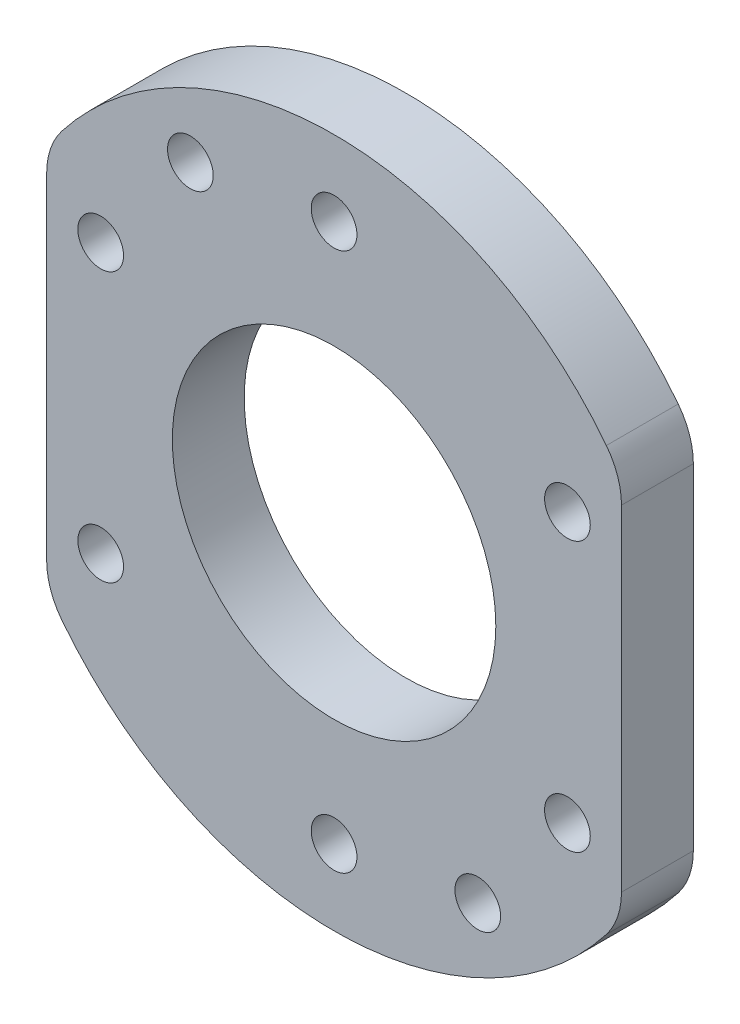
SolidWorks part; units mm, degrees
ref_plane "Front" through (0, 0, 0) normal (0, 0, 1) x (1, 0, 0)
ref_plane "Top" through (0, 0, 0) normal (0, 1, 0) x (1, 0, 0)
ref_plane "Right" through (0, 0, 0) normal (1, 0, 0) x (0, 0, -1)
sketch "Sketch1" plane through (0, 0, 0) normal (0, 0, 1) x (1, 0, 0)
  line L0 (-25.4, 16.8485) -> (-25.4, -16.8485)
  line L1 (-7.3323, 0) -> (-3.6662, -6.35)
  line L2 (-3.6662, -6.35) -> (3.6662, -6.35)
  line L3 (3.6662, -6.35) -> (7.3323, 0)
  line L4 (7.3323, 0) -> (3.6662, 6.35)
  line L5 (3.6662, 6.35) -> (-3.6662, 6.35)
  line L6 (-3.6662, 6.35) -> (-7.3323, 0)
  line L7 (25.4, 16.8485) -> (25.4, -16.8485)
  circle A0 centre (0, 0) radius 6.35 construction
  circle A1 centre (0, 0) radius 30.48
  circle A2 centre (0, 0) radius 23.8125 construction
  dimension "D2" = 60.96
  dimension "D3" = 47.625
  dimension "D1" = 12.7
  dimension "D4" = 25.4
  dimension "D5" = 25.4
extrude "Boss-Extrude1" add sketch "Sketch1" along normal blind 6.35 contours L7 A1 L0 L6 L5 L4 L3 L2 L1
hole_wizard "Tap Drill for #10-32 Tap3" positions "3DSketch2" profile "Sketch4" hole size "#10-32" standard "ANSI Inch"
sketch3d "3DSketch2"
  line L0 (0, 23.8125, 6.35) -> (0, 0, 6.35) construction
  point P0 (0, 23.8125, 6.35)
  point P3 (0, 23.8125, 6.35)
  point P17 (0, 23.8125, 6.35)
  dimension "D1" = 23.8125
sketch "Sketch4" plane through (0, 23.8125, 6.35) normal (1, 0, 0) x (0, -1, 0)
  line L0 (0, 0) -> (0, 6.35)
  line L1 (0, 6.35) -> (2.0193, 6.35)
  line L2 (2.0193, 6.35) -> (2.0193, 0)
  line L5 (2.0193, 0) -> (0, 0)
  line L11 (0, -6.35) -> (0, 107.95) construction
  dimension "Thru Hole Dia." = 4.0386
  dimension "Thru Hole Depth" = 6.35
pattern_circular "CirPattern1" count 6 over 360 about axis through (0, 0, 0) along (0, 0, 1) of "Tap Drill for #10-32 Tap3"
fillet "Fillet1" radius 6.35 4 edges at (25.4, 16.8485, 3.175) (25.4, -16.8485, 3.175) (-25.4, -16.8485, 3.175) (-25.4, 16.8485, 3.175)
sketch "Sketch5" plane through (0, 0, 0) normal (0, 0, -1) x (-1, 0, 0)
  line L1 (0, 0) -> (20.475, -20.475) construction
  line L2 (-3.6662, 6.35) -> (3.6662, 6.35) construction
  dimension "D2" = 45
  dimension "D3" = 28.956
sketch "Sketch9" plane through (0, 0, 6.35) normal (0, 0, 1) x (1, 0, 0)
  line L0 (-12.7, 21.997) -> (12.7, -21.997) construction
  line L1 (20.6222, -11.9063) -> (0, -23.8125) construction
  circle A0 centre (-12.7, 21.997) radius 2.3813
  circle A1 centre (12.7, -21.997) radius 2.3813
  point P2 (0, 0)
  point P6 (20.6222, -11.9063)
  point P7 (0, -23.8125)
  dimension "D1" = 4.7625
  dimension "D2" = 50.8
sketch "Sketch10" plane through (0, 0, 6.35) normal (0, 0, 1) x (1, 0, 0)
  circle A0 centre (0, 0) radius 14.2938
  dimension "D1" = 28.5877
extrude "Cut-Extrude2" cut sketch "Sketch10" against normal blind 6.35
hole_wizard "#10-32 Tapped Hole1" positions "3DSketch3" profile "Sketch11" tap size "#10-32" standard "ANSI Inch"
sketch3d "3DSketch3"
  point P0 (-12.7, 21.997, 6.35)
  point P3 (12.7, -21.997, 6.35)
sketch "Sketch11" plane through (-12.7, 21.997, 6.35) normal (1, 0, 0) x (0, -1, 0)
  line L0 (0, 0) -> (0, 6.35)
  line L1 (0, 6.35) -> (2.0193, 6.35)
  line L2 (2.0193, 6.35) -> (2.0193, 0)
  line L5 (2.0193, 0) -> (0, 0)
  line L11 (0, -6.35) -> (0, 107.95) construction
  dimension "Thru Tap Drill Dia." = 4.0386
  dimension "Thru Tap Drill Depth" = 6.35
